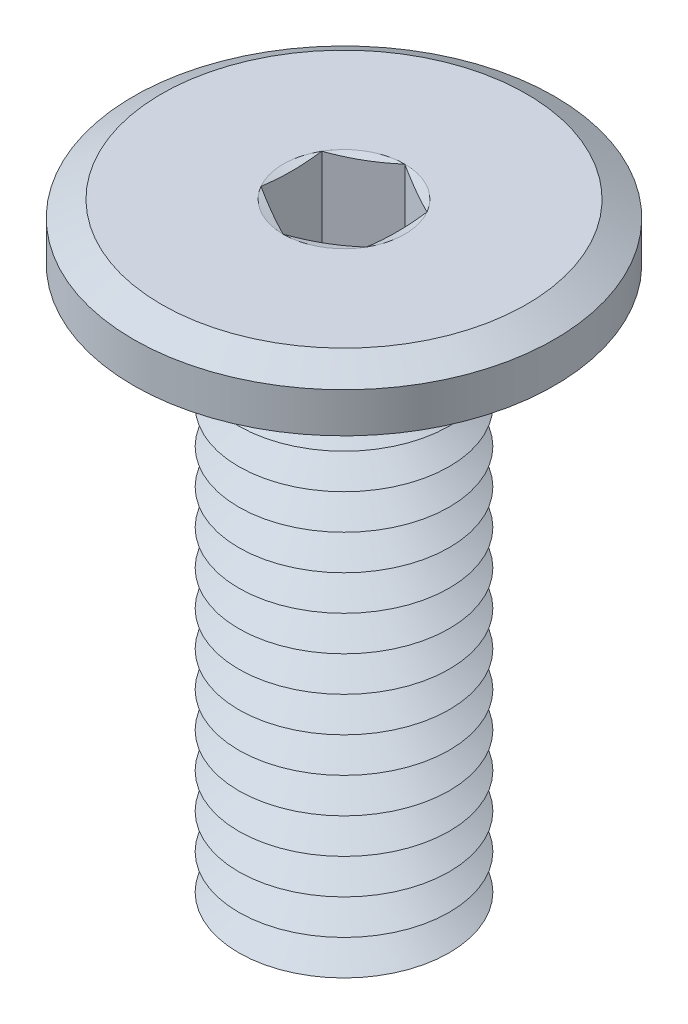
SolidWorks part; units mm, degrees
ref_plane "Front Plane" through (0, 0, 0) normal (0, 0, 1) x (1, 0, 0)
ref_plane "Top Plane" through (0, 0, 0) normal (0, 1, 0) x (1, 0, 0)
ref_plane "Right Plane" through (0, 0, 0) normal (1, 0, 0) x (0, 0, -1)
sketch "Sketch1" plane through (0, 0, 0) normal (0, 1, 0) x (1, 0, 0)
  circle A0 centre (0, 0) radius 3
  dimension "D1" = 6
extrude "Boss-Extrude1" add sketch "Sketch1" against normal blind 0.8
sketch "Sketch2" plane through (0, -0.8, 0) normal (0, -1, 0) x (1, 0, 0)
  circle A0 centre (0, 0) radius 1.5
  dimension "D1" = 3
extrude "Boss-Extrude2" add sketch "Sketch2" along normal blind 8
sketch "Sketch3" plane through (0, 0, 0) normal (1, 0, 0) x (0, 0, -1)
  line L0 (0, 0.9906) -> (0, -8.2999) construction
sketch "Sketch5" plane through (0, 0, 0) normal (1, 0, 0) x (0, 0, -1)
  line L0 (-1.5, -9.05) -> (-1.067, -8.8)
  line L1 (-1.5, -0.8) -> (-1.5, -8.8) construction
  line L2 (-1.067, -8.8) -> (-1.5, -8.55)
  line L3 (-1.5, -0.8) -> (-1.5, -8.8) construction
  line L4 (-1.5, -8.55) -> (-1.5, -9.05)
  line L6 (-1.5, -0.8) -> (-1.5, -8.8) construction
  line L7 (-1.5, -0.8) -> (-1.5, -8.8) construction
  line L14 (-1.5, -8.8) -> (1.5, -8.8) construction
  dimension "D1" = 0.5
revolve "Cut-Revolve1" cut sketch "Sketch5" angle 360 about L0
pattern_linear "LPattern1" count 15 spacing 0.5 along (0, 1, 0) of "Cut-Revolve1"
fillet "Fillet1" radius 0.1 1 edges at (0, -0.8, -1.5)
chamfer "Chamfer2" distance 0.4 angle 30 1 edges at (0, 0, 3)
sketch "Sketch6" plane through (0, 0, 0) normal (0, 1, 0) x (1, 0, 0)
  line L1 (0, 0.866) -> (-0.75, 0.433)
  line L2 (-0.75, 0.433) -> (-0.75, -0.433)
  line L3 (-0.75, -0.433) -> (0, -0.866)
  line L4 (0, -0.866) -> (0.75, -0.433)
  line L5 (0.75, -0.433) -> (0.75, 0.433)
  line L6 (0.75, 0.433) -> (0, 0.866)
  circle A0 centre (0, 0) radius 0.75 construction
  dimension "D1" = 1.5
extrude "Cut-Extrude1" cut sketch "Sketch6" against normal blind 1.4
sketch "Sketch7" plane through (0, -1.4, 0) normal (0, 1, 0) x (1, 0, 0)
  line L0 (-0.75, 0.433) -> (-0.75, -0.433) construction
  circle A0 centre (0, 0) radius 0.75
extrude "Cut-Extrude2" cut sketch "Sketch7" against normal through all draft 60
sketch "Sketch8" plane through (0, 0, 0) normal (0, 1, 0) x (1, 0, 0)
  circle A0 centre (0, 0) radius 0.866
extrude "Cut-Extrude3" cut sketch "Sketch8" against normal through all draft 75
